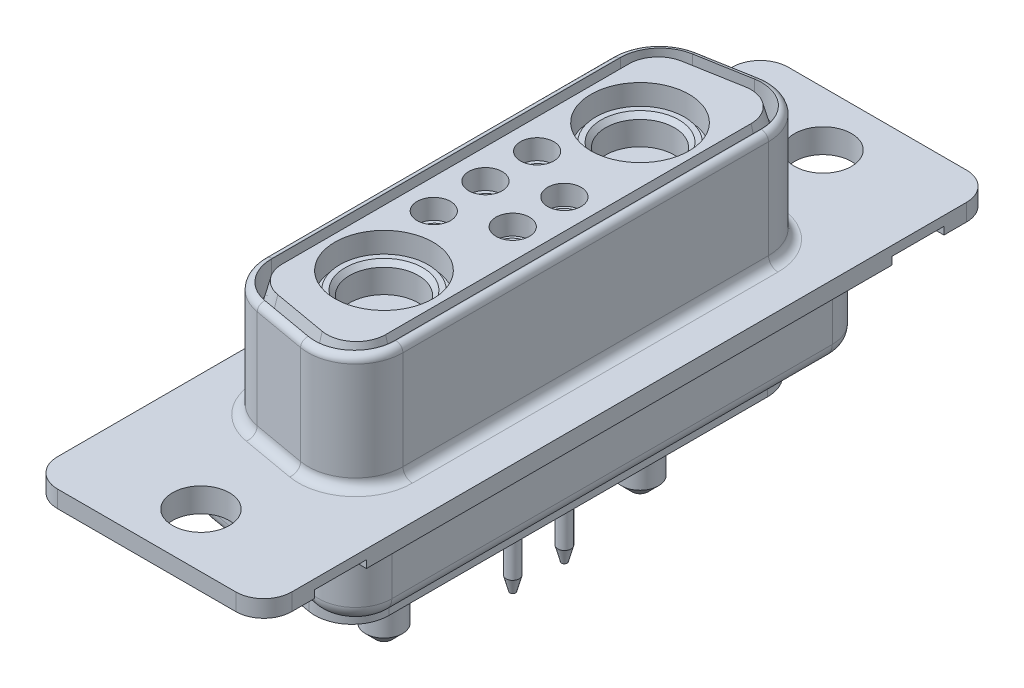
SolidWorks part; units mm, degrees
ref_plane "Front Plane" through (0, 0, 0) normal (0, 0, 1) x (1, 0, 0)
ref_plane "Top Plane" through (0, 0, 0) normal (0, 1, 0) x (1, 0, 0)
ref_plane "Right Plane" through (0, 0, 0) normal (1, 0, 0) x (0, 0, -1)
sketch "Sketch1" plane through (0, 0, 0) normal (0, 1, 0) x (1, 0, 0)
  line L0 (6.2738, -19.5707) -> (-6.2738, 19.5707) construction
  line L1 (4.7752, -19.5707) -> (-4.7752, -19.5707)
  line L2 (6.2738, -18.0721) -> (6.2738, -16.8656)
  line L3 (4.7752, 19.5707) -> (-4.7752, 19.5707)
  line L4 (-6.2738, -18.0721) -> (-6.2738, -16.8656)
  line L5 (6.2738, 16.8656) -> (5.0038, 16.8656)
  line L6 (5.0038, 16.8656) -> (5.0038, 14.0716)
  line L7 (5.0038, 14.0716) -> (6.2738, 14.0716)
  line L8 (0, 0) -> (0, 5.0825) construction
  line L9 (-5.0038, 14.0716) -> (-6.2738, 14.0716)
  line L10 (-5.0038, 16.8656) -> (-5.0038, 14.0716)
  line L11 (-6.2738, 16.8656) -> (-5.0038, 16.8656)
  line L12 (0, 0) -> (-3.6635, 0) construction
  line L13 (-6.2738, -16.8656) -> (-5.0038, -16.8656)
  line L14 (-5.0038, -16.8656) -> (-5.0038, -14.0716)
  line L15 (-5.0038, -14.0716) -> (-6.2738, -14.0716)
  line L16 (5.0038, -14.0716) -> (6.2738, -14.0716)
  line L17 (5.0038, -16.8656) -> (5.0038, -14.0716)
  line L18 (6.2738, -16.8656) -> (5.0038, -16.8656)
  line L19 (6.2738, 16.8656) -> (6.2738, 18.0721)
  line L20 (-6.2738, 16.8656) -> (-6.2738, 18.0721)
  line L21 (-6.2738, -14.0716) -> (-6.2738, 14.0716)
  line L22 (6.2738, -14.0716) -> (6.2738, 14.0716)
  arc A0 (6.2738, 18.0721) -> (4.7752, 19.5707) centre (4.7752, 18.0721) ccw
  arc A1 (-4.7752, 19.5707) -> (-6.2738, 18.0721) centre (-4.7752, 18.0721) ccw
  arc A2 (-4.7752, -19.5707) -> (-6.2738, -18.0721) centre (-4.7752, -18.0721) cw
  arc A3 (6.2738, -18.0721) -> (4.7752, -19.5707) centre (4.7752, -18.0721) cw
  dimension "D3" = 1.4986
  dimension "D1" = 12.5476
  dimension "D2" = 39.1414
  dimension "D4" = 2.794
  dimension "D5" = 1.27
  dimension "D6" = 14.0716
extrude "Extrude1" add sketch "Sketch1" along normal blind 0.4064
sketch "Sketch2" plane through (0, 0.4064, 0) normal (0, 1, 0) x (-1, 0, 0)
  line L20 (-4.7752, -19.5707) -> (4.7752, -19.5707)
  line L21 (6.2738, -18.0721) -> (6.2738, -16.8656)
  line L22 (6.2738, -16.8656) -> (5.0038, -16.8656)
  line L23 (5.0038, -16.8656) -> (5.0038, -14.0716)
  line L24 (5.0038, -14.0716) -> (6.2738, -14.0716)
  line L25 (6.2738, -14.0716) -> (6.2738, 14.0716)
  line L26 (6.2738, 14.0716) -> (5.0038, 14.0716)
  line L27 (5.0038, 14.0716) -> (5.0038, 16.8656)
  line L28 (5.0038, 16.8656) -> (6.2738, 16.8656)
  line L29 (6.2738, 16.8656) -> (6.2738, 18.0721)
  line L30 (4.7752, 19.5707) -> (-4.7752, 19.5707)
  line L31 (-6.2738, 18.0721) -> (-6.2738, 16.8656)
  line L32 (-6.2738, 16.8656) -> (-5.0038, 16.8656)
  line L33 (-5.0038, 16.8656) -> (-5.0038, 14.0716)
  line L34 (-5.0038, 14.0716) -> (-6.2738, 14.0716)
  line L35 (-6.2738, 14.0716) -> (-6.2738, -14.0716)
  line L36 (-6.2738, -14.0716) -> (-5.0038, -14.0716)
  line L37 (-5.0038, -14.0716) -> (-5.0038, -16.8656)
  line L38 (-5.0038, -16.8656) -> (-6.2738, -16.8656)
  line L39 (-6.2738, -16.8656) -> (-6.2738, -18.0721)
  line L40 (-4.7752, -19.5707) -> (4.7752, -19.5707)
  line L41 (6.2738, -18.0721) -> (6.2738, 16.8656)
  line L49 (6.2738, 16.8656) -> (6.2738, 18.0721)
  line L50 (4.7752, 19.5707) -> (-4.7752, 19.5707)
  line L51 (-6.2738, 18.0721) -> (-6.2738, 16.8656)
  line L59 (-6.2738, 16.8656) -> (-6.2738, -18.0721)
  arc A4 (-6.2738, -18.0721) -> (-4.7752, -19.5707) centre (-4.7752, -18.0721) ccw
  arc A5 (4.7752, -19.5707) -> (6.2738, -18.0721) centre (4.7752, -18.0721) ccw
  arc A6 (6.2738, 18.0721) -> (4.7752, 19.5707) centre (4.7752, 18.0721) ccw
  arc A7 (-4.7752, 19.5707) -> (-6.2738, 18.0721) centre (-4.7752, 18.0721) ccw
  arc A8 (-6.2738, -18.0721) -> (-4.7752, -19.5707) centre (-4.7752, -18.0721) ccw
  arc A9 (4.7752, -19.5707) -> (6.2738, -18.0721) centre (4.7752, -18.0721) ccw
  arc A10 (6.2738, 18.0721) -> (4.7752, 19.5707) centre (4.7752, 18.0721) ccw
  arc A11 (-4.7752, 19.5707) -> (-6.2738, 18.0721) centre (-4.7752, 18.0721) ccw
  dimension "D1" = 0
extrude "Extrude2" add sketch "Sketch2" along normal blind 0.508
sketch "Sketch3" plane through (0, 0.9144, 0) normal (0, 1, 0) x (-1, 0, 0)
  line L0 (-3.9497, -9.7917) -> (-3.9497, 9.7917)
  line L1 (3.9497, -9.2946) -> (3.9497, 9.2946)
  line L2 (-0.9686, -12.2931) -> (1.8508, -11.796)
  line L3 (0, 0) -> (0, -12.1223) construction
  line L4 (0, 0) -> (-14.3379, 0) construction
  line L5 (-0.9686, 12.2931) -> (1.8508, 11.796)
  arc A0 (-0.9686, -12.2931) -> (-3.9497, -9.7917) centre (-1.4097, -9.7917) cw
  arc A1 (3.9497, -9.2946) -> (1.8508, -11.796) centre (1.4097, -9.2946) cw
  arc A2 (3.9497, 9.2946) -> (1.8508, 11.796) centre (1.4097, 9.2946) ccw
  arc A3 (-0.9686, 12.2931) -> (-3.9497, 9.7917) centre (-1.4097, 9.7917) ccw
  dimension "D4" = 2.54
  dimension "D1" = 100
  dimension "D2" = 3.9497
  dimension "D3" = 7.8994
  dimension "D5" = 12.3317
extrude "Extrude3" add sketch "Sketch3" along normal blind 6.1722
sketch "Sketch5" plane through (0, 0, 0) normal (1, 0, 0) x (0, 0, -1)
  line L0 (-16.6624, 4.9276) -> (-16.6624, -5.6896) construction
  line L1 (-14.2875, 0) -> (-14.2875, -0.0508)
  line L3 (-14.0716, 0) -> (14.0716, 0) construction
  line L4 (-14.6177, -0.381) -> (-15.1384, -0.381)
  line L6 (-16.8656, 0) -> (-14.0716, 0) construction
  line L7 (-15.1384, 0) -> (-14.2875, 0)
  line L8 (-15.1384, 0) -> (-15.1384, -0.381)
  arc A0 (-14.6177, -0.381) -> (-14.2875, -0.0508) centre (-14.6177, -0.0508) ccw
  dimension "D5" = 1.524
  dimension "D3" = 0.381
  dimension "D4" = 0.3302
  dimension "D1" = 16.6624
  dimension "D2" = 2.3749
revolve "Revolve1" add sketch "Sketch5" angle 360 about L0
mirror "Mirror1" about plane through (0, 0, 0) normal (0, 0, 1) of "Revolve1"
sketch "Sketch6" plane through (0, 0, 0) normal (0, -1, 0) x (1, 0, 0)
  line L0 (5.3594, 11.7968) -> (5.3594, -11.7968)
  line L1 (-5.3594, 10.5965) -> (-5.3594, -10.5965)
  line L2 (3.064, 13.7229) -> (-3.7432, 12.5226)
  line L3 (0, 0) -> (0, 13.1826) construction
  line L4 (0, 0) -> (13.9712, 0) construction
  line L5 (3.064, -13.7229) -> (-3.7432, -12.5226)
  arc A0 (3.064, 13.7229) -> (5.3594, 11.7968) centre (3.4036, 11.7968) cw
  arc A1 (-5.3594, 10.5965) -> (-3.7432, 12.5226) centre (-3.4036, 10.5965) cw
  arc A2 (-5.3594, -10.5965) -> (-3.7432, -12.5226) centre (-3.4036, -10.5965) ccw
  arc A3 (3.064, -13.7229) -> (5.3594, -11.7968) centre (3.4036, -11.7968) ccw
  dimension "D3" = 1.9558
  dimension "D1" = 5.3594
  dimension "D2" = 10.7188
  dimension "D4" = 13.1826
  dimension "D5" = 100
extrude "Extrude4" add sketch "Sketch6" along normal blind 3.81
fillet "Fillet2" radius 0.8128 16 edges at (4.6608, -3.81, 13.295) (5.3594, -3.81, 0) (4.6608, -3.81, -13.295) (-0.3396, -3.81, -13.1227) (-4.9018, -3.81, -11.8536) (-5.3594, -3.81, 0) (-4.9018, -3.81, 11.8536) (-4.9018, 0, 11.8536) (-0.3396, 0, 13.1227) (4.6608, 0, 13.295) (5.3594, 0, 0) (4.6608, 0, -13.295) (-0.3396, 0, -13.1227) (-4.9018, 0, -11.8536) (-0.3396, -3.81, 13.1227) (-5.3594, 0, 0)
sketch "Sketch7" plane through (0, 7.0866, 0) normal (0, 1, 0) x (-1, 0, 0)
  line L0 (-3.5433, -9.8439) -> (-3.5433, 9.8439)
  line L1 (3.5433, -9.3468) -> (3.5433, 9.3468)
  line L2 (-1.0392, -11.9451) -> (1.7802, -11.4479)
  line L3 (0, 0) -> (-13.0178, 0) construction
  line L4 (-1.0392, 11.9451) -> (1.7802, 11.4479)
  line L5 (0, 0) -> (0.2974, -11.7094) construction
  arc A0 (-1.0392, -11.9451) -> (-3.5433, -9.8439) centre (-1.4097, -9.8439) cw
  arc A1 (3.5433, -9.3468) -> (1.7802, -11.4479) centre (1.4097, -9.3468) cw
  arc A2 (3.5433, 9.3468) -> (1.7802, 11.4479) centre (1.4097, 9.3468) ccw
  arc A3 (-1.0392, 11.9451) -> (-3.5433, 9.8439) centre (-1.4097, 9.8439) ccw
  dimension "D4" = 2.1336
  dimension "D1" = 100
  dimension "D2" = 3.5433
  dimension "D3" = 7.0866
  dimension "D5" = 11.7094
ref_plane "Plane1" through (-1.4224, 0, 0) normal (1, 0, 0) x (0, 0, -1)
sketch "Sketch12" plane through (0, -3.81, 0) normal (0, -1, 0) x (1, 0, 0)
  line L0 (3.683, 11.2282) -> (3.683, -11.2282)
  line L1 (2.2819, 12.4039) -> (-2.6965, 11.526)
  line L2 (-3.683, 10.3504) -> (-3.683, -10.3504)
  line L3 (0, 0) -> (0, 12.0015) construction
  line L4 (0, 0) -> (13.7549, 0) construction
  line L5 (2.2819, -12.4039) -> (-2.6965, -11.526)
  arc A0 (3.683, 11.2282) -> (2.2819, 12.4039) centre (2.4892, 11.2282) ccw
  arc A1 (-3.683, 10.3504) -> (-2.6965, 11.526) centre (-2.4892, 10.3504) cw
  arc A2 (-3.683, -10.3504) -> (-2.6965, -11.526) centre (-2.4892, -10.3504) ccw
  arc A3 (3.683, -11.2282) -> (2.2819, -12.4039) centre (2.4892, -11.2282) cw
  dimension "D4" = 1.1938
  dimension "D1" = 3.683
  dimension "D2" = 7.366
  dimension "D3" = 100
  dimension "D5" = 12.0015
extrude "Cut-Extrude6" cut sketch "Sketch12" against normal blind 0.4064
sketch "Sketch13" plane through (0, -3.4036, 0) normal (0, -1, 0) x (1, 0, 0)
  line L0 (3.5433, 10.1382) -> (3.5433, -10.1382)
  line L1 (1.2181, 12.0893) -> (-1.9061, 11.5384)
  line L2 (-3.5433, 9.5873) -> (-3.5433, -9.5873)
  line L3 (0, 0) -> (0, 11.8745) construction
  line L4 (0, 0) -> (12.7061, 0) construction
  line L5 (1.2181, -12.0893) -> (-1.9061, -11.5384)
  arc A0 (1.2181, 12.0893) -> (3.5433, 10.1382) centre (1.5621, 10.1382) cw
  arc A1 (-3.5433, 9.5873) -> (-1.9061, 11.5384) centre (-1.5621, 9.5873) cw
  arc A2 (-3.5433, -9.5873) -> (-1.9061, -11.5384) centre (-1.5621, -9.5873) ccw
  arc A3 (1.2181, -12.0893) -> (3.5433, -10.1382) centre (1.5621, -10.1382) ccw
  dimension "D4" = 1.9812
  dimension "D1" = 100
  dimension "D2" = 3.5433
  dimension "D3" = 7.0866
  dimension "D5" = 11.8745
extrude "Extrude5" add sketch "Sketch13" along normal blind 2.1082
sketch "Sketch14" plane through (0, -5.5118, 0) normal (0, -1, 0) x (1, 0, 0)
  line L0 (6.2738, -14.0716) -> (6.2738, -16.8656) construction
  line L1 (0, 0) -> (10.5279, 0) construction
  circle A0 centre (0, -6.858) radius 2.7813
  circle A1 centre (0, 6.858) radius 2.7813
  dimension "D3" = 5.5626
  dimension "D1" = 6.2738
  dimension "D2" = 6.858
sketch "Sketch15" plane through (0, -5.5118, 0) normal (0, -1, 0) x (1, 0, 0)
  line L0 (-1.4224, -9.3702) -> (-1.4224, 9.3702) construction
  circle A0 centre (-1.4224, -2.7686) radius 0.8953
  dimension "D1" = 1.7907
  dimension "D2" = 2.7686
extrude "Cut-Extrude8" cut sketch "Sketch15" against normal blind 1.397
pattern_linear "LPattern3" count 5 spacing 1.3843 along (0, 0, 1) count 2 spacing 2.8448 along (1, 0, 0) of "Cut-Extrude8"
sketch "Sketch16" plane through (-1.4224, 0, 0) normal (1, 0, 0) x (0, 0, -1)
  line L0 (2.7686, -2.2162) -> (2.7686, -10.6063) construction
  line L1 (2.7686, -4.1148) -> (3.6576, -4.1148)
  line L2 (3.6576, -4.1148) -> (3.5232, -4.8768)
  line L3 (3.5232, -4.8768) -> (3.1242, -5.08)
  line L4 (3.1242, -9.0678) -> (2.92, -9.8298)
  line L5 (3.1242, -5.08) -> (3.1242, -9.0678)
  line L6 (10.1382, -5.5118) -> (-10.1382, -5.5118) construction
  line L7 (2.92, -9.8298) -> (2.7686, -9.8298)
  line L12 (2.7686, -4.1148) -> (2.7686, -9.8298)
  dimension "D1" = 2.7686
  dimension "D2" = 1.397
  dimension "D3" = 80
  dimension "D4" = 0.762
  dimension "D5" = 0.3556
  dimension "D6" = 0.9652
  dimension "D7" = 0.889
  dimension "D8" = 4.318
  dimension "D9" = 15
  dimension "D10" = 0.762
revolve "Revolve3" add sketch "Sketch16" angle 360 about L0
ref_plane "Plane2" through (0, 0, -2.7686) normal (0, 0, 1) x (1, 0, 0)
pattern_linear "LPattern4" count 5 spacing 1.3843 along (0, 0, 1) count 2 spacing 2.8448 along (1, 0, 0) of "Revolve3"
ref_plane "Plane3" through (1.3462, 0, 0) normal (1, 0, 0) x (0, 0, -1)
ref_plane "Plane4" through (0, 0, -1.3843) normal (0, 0, 1) x (1, 0, 0)
extrude "Cut-Extrude11" cut sketch "Sketch7" against normal blind 1.524
fillet "Fillet4" radius 0.381 6 edges at (-3.3555, 7.0866, -10.9272) (3.0424, 7.0866, -11.7375) (3.9497, 7.0866, 0) (3.0424, 7.0866, 11.7375) (-3.3555, 7.0866, 10.9272) (-3.9497, 7.0866, 0)
fillet "Fillet5" radius 0.508 8 edges at (-3.3555, 0.9144, -10.9272) (-0.4411, 0.9144, -12.0445) (3.0424, 0.9144, -11.7375) (3.9497, 0.9144, 0) (3.0424, 0.9144, 11.7375) (-0.4411, 0.9144, 12.0445) (-3.3555, 0.9144, 10.9272) (-3.9497, 0.9144, 0)
sketch "Sketch22" plane through (0, 5.5626, 0) normal (0, 1, 0) x (-1, 0, 0)
  line L0 (-3.429, -9.7878) -> (-3.429, 9.7878)
  line L1 (-1.1038, -11.7389) -> (1.7918, -11.2284)
  line L2 (3.429, -9.2773) -> (3.429, 9.2773)
  line L3 (0, 0) -> (0, -11.5443) construction
  line L4 (0, 0) -> (-10.3248, 0) construction
  line L5 (-1.1038, 11.7389) -> (1.7918, 11.2284)
  arc A0 (3.429, -9.2773) -> (1.7918, -11.2284) centre (1.4478, -9.2773) cw
  arc A1 (-3.429, -9.7878) -> (-1.1038, -11.7389) centre (-1.4478, -9.7878) ccw
  arc A2 (-3.429, 9.7878) -> (-1.1038, 11.7389) centre (-1.4478, 9.7878) cw
  arc A3 (3.429, 9.2773) -> (1.7918, 11.2284) centre (1.4478, 9.2773) ccw
  dimension "D4" = 1.9812
  dimension "D1" = 100
  dimension "D2" = 3.429
  dimension "D3" = 6.858
  dimension "D5" = 11.5443
extrude "Extrude6" add sketch "Sketch22" along normal blind 1.524 draft 15
sketch "Sketch23" plane through (0, 7.0866, 0) normal (0, 1, 0) x (-1, 0, 0)
  line L0 (-6.2738, 18.0721) -> (-6.2738, -18.0721) construction
  circle A0 centre (0, 6.858) radius 2.6289
  circle A1 centre (0, -6.858) radius 2.6289
  dimension "D1" = 5.2578
  dimension "D2" = 5.2578
  dimension "D6" = 6.858
  dimension "D3" = 6.2738
  dimension "D4" = 6.2738
  dimension "D5" = 6.858
extrude "Cut-Extrude12" cut sketch "Sketch23" against normal blind 1.2446
sketch "Sketch24" plane through (0, 7.0866, 0) normal (0, 1, 0) x (-1, 0, 0)
  line L0 (0, 0) -> (-5.4448, 0) construction
  circle A1 centre (1.4224, 2.7686) radius 0.8953
  circle A2 centre (1.4224, -2.7686) radius 0.8953
  circle A3 centre (-1.4224, 1.3843) radius 0.8953
  circle A4 centre (-1.4224, -1.3843) radius 0.8953
  circle A5 centre (1.4224, 0) radius 0.8954
  circle A7 centre (-1.4224, -2.7686) radius 0.8953
  circle A8 centre (-1.4224, 0) radius 0.8953
  circle A9 centre (1.4224, -1.3843) radius 0.8953
  dimension "D1" = 1.7907
  dimension "D3" = 1.4224
  dimension "D2" = 2.7686
extrude "Cut-Extrude13" cut sketch "Sketch24" against normal blind 1.5748
sketch "Sketch25" plane through (0, 0, -2.7686) normal (0, 0, 1) x (1, 0, 0)
  line L1 (-1.7802, 7.0857) -> (1.0303, 7.0857) construction
  line L2 (-1.3843, 9.2293) -> (-1.3843, 2.2878) construction
  line L3 (-0.3937, 5.5118) -> (-1.3843, 5.5118)
  line L4 (-0.3937, 5.5118) -> (-0.3937, 5.8928)
  line L5 (-0.3937, 5.8928) -> (-0.4584, 6.0198)
  line L6 (-0.4584, 6.0198) -> (-0.6495, 6.0198)
  line L7 (-0.6495, 6.0198) -> (-0.8255, 5.715)
  line L8 (-0.8255, 5.715) -> (-0.8255, 5.5828)
  line L9 (-0.8255, 5.5828) -> (-1.3843, 5.5828)
  line L10 (-1.3843, 5.5118) -> (-1.3843, 5.5828)
  dimension "D1" = 1.3843
  dimension "D2" = 27
  dimension "D3" = 30
  dimension "D4" = 0.3048
  dimension "D5" = 0.127
  dimension "D6" = 1.5739
  dimension "D7" = 0.9906
  dimension "D8" = 1.0659
  dimension "D9" = 0.5588
revolve "Revolve5" add sketch "Sketch25" angle 360 about L2
sketch "Sketch26" plane through (0, 6.0198, 0) normal (0, 1, 0) x (-1, 0, 0)
  line L0 (0.5401, -2.6162) -> (2.2976, -2.6162)
  line L1 (0.5401, -2.921) -> (2.2976, -2.921)
  arc A2 (2.1333, -3.3129) -> (2.1333, -2.2243) centre (1.3843, -2.7686) ccw
  arc A3 (2.1333, -2.2243) -> (2.1333, -3.3129) centre (1.4224, -2.7686) ccw
  arc A4 (2.2976, -2.921) -> (2.2976, -2.6162) centre (1.3843, -2.7686) ccw
  arc A5 (0.5401, -2.6162) -> (0.5401, -2.921) centre (1.4224, -2.7686) ccw
  dimension "D2" = 0.1524
  dimension "D3" = 0.3048
  dimension "D1" = 0
extrude "Cut-Extrude14" cut sketch "Sketch26" against normal blind 0.3048
pattern_linear "LPattern6" count 2 spacing 2.7686 count 5 spacing 1.3843 along (0, 0, 1) of "Cut-Extrude14", "Revolve5"
ref_plane "Plane5" through (0, 3.3909, 0) normal (0, 1, 0) x (-1, 0, 0)
sketch "Sketch29" plane through (0, 0, 0) normal (1, 0, 0) x (0, 0, -1)
  line L0 (-9.7917, 7.0866) -> (9.7917, 7.0866) construction
  line L1 (-6.858, 5.842) -> (-9.2202, 5.842)
  line L2 (-6.858, 5.842) -> (-6.858, -8.4099) construction
  line L3 (-9.2202, 5.842) -> (-9.2202, 6.1722)
  line L4 (-9.2202, 6.1722) -> (-8.9408, 6.1722)
  line L5 (-8.9408, 6.1722) -> (-8.6995, 5.9309)
  line L6 (-6.858, 5.9309) -> (-8.6995, 5.9309)
  line L7 (-6.858, 5.9309) -> (-6.858, 5.842)
  dimension "D1" = 6.858
  dimension "D2" = 0.3302
  dimension "D3" = 2.3622
  dimension "D4" = 45
  dimension "D5" = 2.0828
  dimension "D6" = 1.8415
  dimension "D7" = 1.2446
  dimension "D8" = 2.3622
  dimension "D9" = 0.9144
  dimension "D10" = 1.1557
  dimension "D11" = 6.858
revolve "Revolve6" add sketch "Sketch29" angle 360 about L2
extrude "Extrude7" add sketch "Sketch14" along normal blind 0.3302
sketch "Sketch30" plane through (0, 0, 0) normal (1, 0, 0) x (0, 0, -1)
  line L0 (-6.858, -5.842) -> (-6.858, -16.3505) construction
  line L1 (-9.6393, -5.842) -> (-4.0767, -5.842) construction
  line L2 (-6.858, -5.842) -> (-4.0767, -5.842)
  line L3 (-4.0767, -5.842) -> (-4.2037, -5.969)
  line L4 (-4.2037, -5.969) -> (-5.8674, -5.969)
  line L5 (-5.8674, -5.969) -> (-5.8674, -9.271)
  line L6 (-5.8674, -9.271) -> (-6.4262, -9.8298)
  line L7 (-6.4262, -9.8298) -> (-6.858, -9.8298)
  line L8 (10.1382, -5.5118) -> (-10.1382, -5.5118) construction
  line L9 (-6.858, -5.842) -> (-6.858, -9.8298)
  dimension "D1" = 0.4572
  dimension "D2" = 0.9906
  dimension "D3" = 45
  dimension "D4" = 0.5588
  dimension "D5" = 4.318
revolve "Revolve7" add sketch "Sketch30" angle 360 about L0
mirror "Mirror2" about plane through (0, 0, 0) normal (0, 0, 1) of "Revolve7", "Revolve6"
sketch "Sketch32" plane through (0, 5.9309, 0) normal (0, 1, 0) x (-1, 0, 0)
  circle A1 centre (0, 6.858) radius 1.8415
  circle A2 centre (0, 6.858) radius 1.8415
  circle A3 centre (0, -6.858) radius 1.8415
  circle A4 centre (0, -6.858) radius 1.8415
  dimension "D1" = 0
  dimension "D2" = 0
extrude "Cut-Extrude17" cut sketch "Sketch32" against normal blind 1.27
sketch "Sketch33" plane through (0, 0, 0) normal (0, -1, 0) x (1, 0, 0)
  circle A1 centre (0, 16.6624) radius 1.524
  circle A2 centre (0, 16.6624) radius 1.524
  circle A3 centre (0, -16.6624) radius 1.524
  circle A4 centre (0, -16.6624) radius 1.524
  dimension "D1" = 0
  dimension "D2" = 0
extrude "Cut-Extrude18" cut sketch "Sketch33" against normal through all
